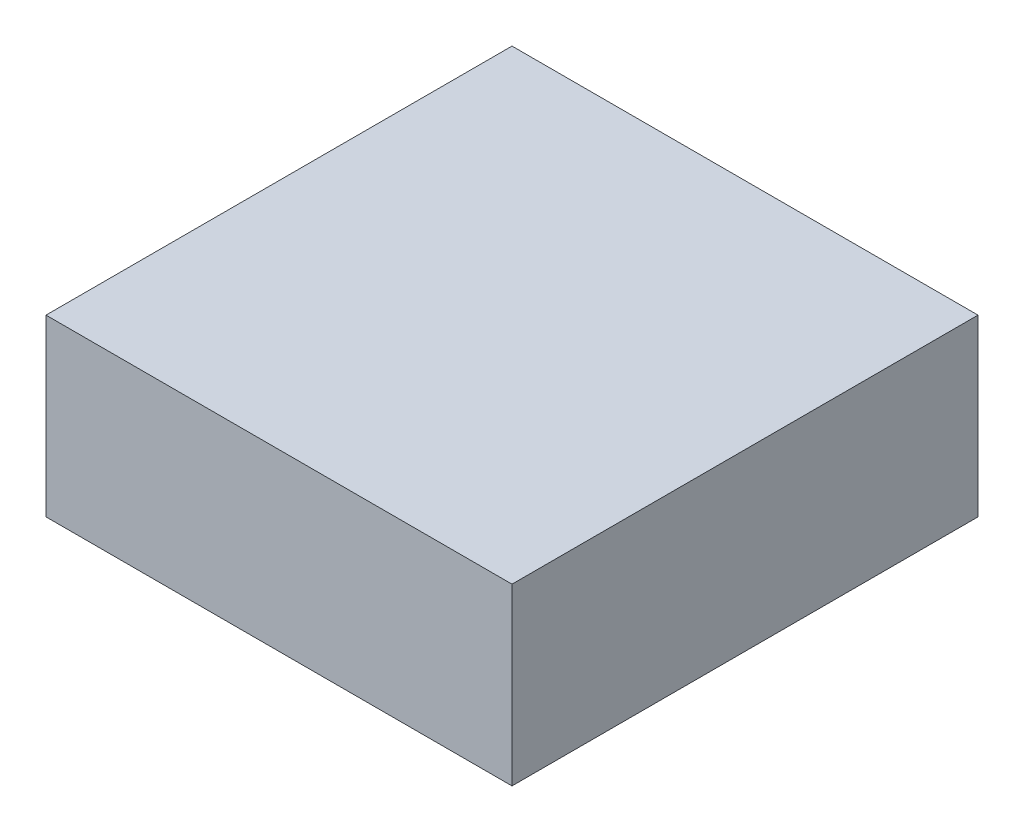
SolidWorks part; units mm, degrees
ref_plane "Front Plane" through (0, 0, 0) normal (0, 0, 1) x (1, 0, 0)
ref_plane "Top Plane" through (0, 0, 0) normal (0, 1, 0) x (1, 0, 0)
ref_plane "Right Plane" through (0, 0, 0) normal (1, 0, 0) x (0, 0, -1)
sketch "Sketch1" plane through (0, 0, 0) normal (1, 0, 0) x (0, 0, -1)
  line L1 (-50.8, -19.05) -> (50.8, -19.05)
  line L2 (-50.8, -19.05) -> (-50.8, 19.05)
  line L3 (-50.8, 19.05) -> (50.8, 19.05)
  line L4 (50.8, -19.05) -> (50.8, 19.05)
  line L5 (-50.8, -19.05) -> (50.8, 19.05) construction
  line L6 (-50.8, 19.05) -> (50.8, -19.05) construction
  point P0 (0, 0)
  dimension "D1" = 38.1
  dimension "D2" = 101.6
extrude "Boss-Extrude1" add sketch "Sketch1" along normal blind 101.6
ref_plane "Plane1" through (50.8, 0, 0) normal (1, 0, 0) x (0, 0, -1)
